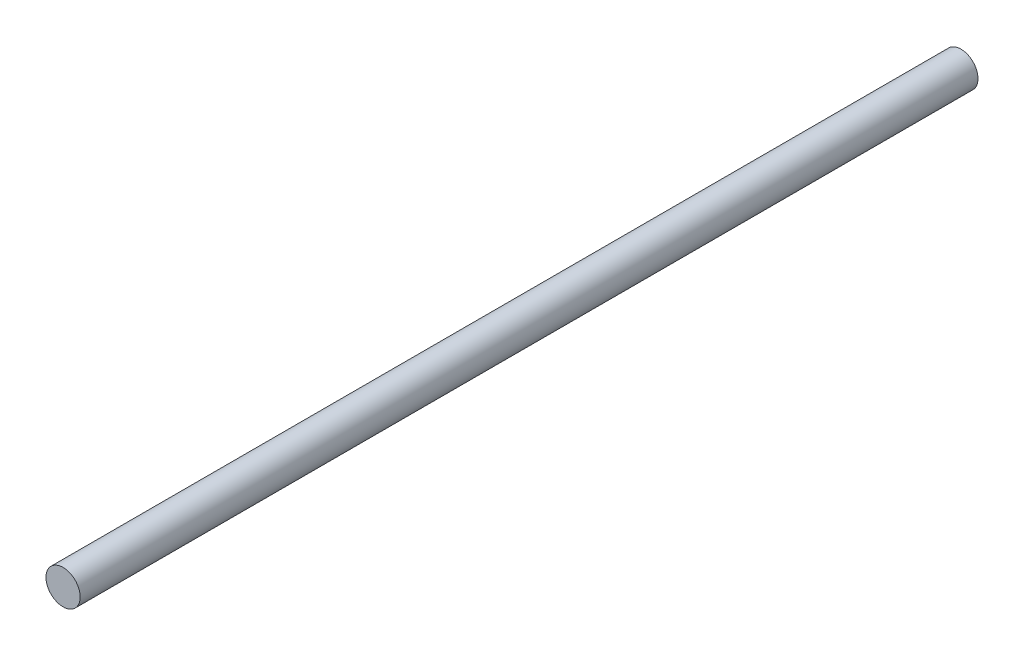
SolidWorks part; units mm, degrees
ref_plane "Alzado" through (0, 0, 0) normal (0, 0, 1) x (1, 0, 0)
ref_plane "Planta" through (0, 0, 0) normal (0, 1, 0) x (1, 0, 0)
ref_plane "Vista lateral" through (0, 0, 0) normal (1, 0, 0) x (0, 0, -1)
sketch "Croquis1" plane through (0, 0, 0) normal (0, 0, 1) x (1, 0, 0)
  circle A0 centre (0, 0) radius 4
  dimension "D1" = 8
extrude "Saliente-Extruir1" add sketch "Croquis1" along normal blind 210
